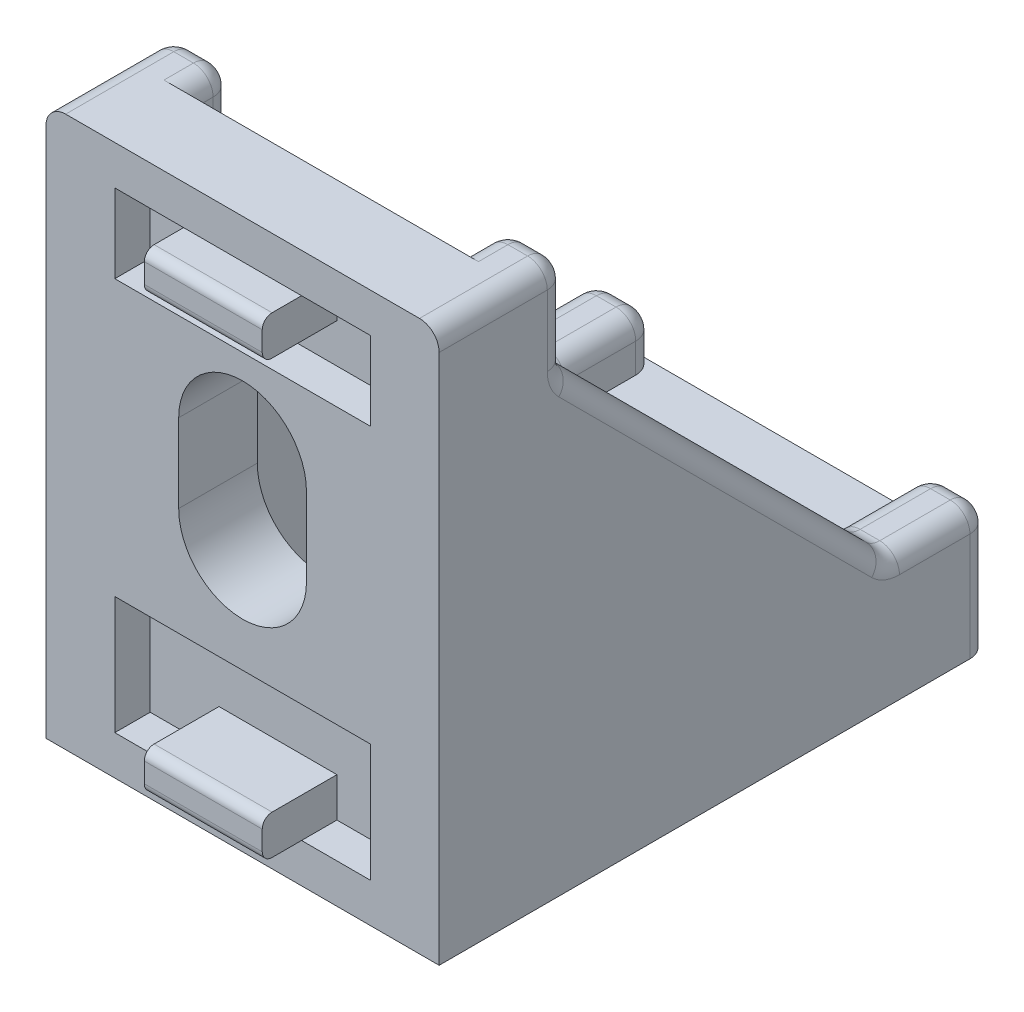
SolidWorks part; units mm, degrees
ref_plane "前视基准面" through (0, 0, 0) normal (0, 0, 1) x (1, 0, 0)
ref_plane "上视基准面" through (0, 0, 0) normal (0, 1, 0) x (1, 0, 0)
ref_plane "右视基准面" through (0, 0, 0) normal (1, 0, 0) x (0, 0, -1)
sketch "草图3" plane through (0, 0, 0) normal (1, 0, 0) x (0, 0, -1)
  line L0 (0, 0) -> (0, 28)
  line L1 (0, 28) -> (4, 28)
  line L2 (4, 28) -> (4, 4)
  line L3 (4, 4) -> (28, 4)
  line L4 (28, 4) -> (28, 0)
  line L5 (28, 0) -> (0, 0)
extrude "凸台-拉伸1" add sketch "草图3" along normal blind 17
sketch "草图6" plane through (17, 0, 0) normal (1, 0, 0) x (0, 0, -1)
  line L0 (4, 28) -> (6.5, 28)
  line L1 (6.5, 28) -> (6.5, 23)
  line L2 (28, 4) -> (28, 6.5)
  line L3 (28, 6.5) -> (23, 6.5)
  line L4 (6.5, 23) -> (23, 6.5)
  line L11 (0, 0) -> (28, 0)
  line L12 (28, 0) -> (28, 4)
  line L13 (28, 4) -> (4, 4)
  line L14 (4, 4) -> (4, 28)
  line L15 (4, 28) -> (0, 28)
  line L16 (0, 28) -> (0, 0)
  line L17 (0, 0) -> (28, 0)
  line L18 (28, 0) -> (28, 4)
  line L21 (4, 28) -> (0, 28)
  line L22 (0, 28) -> (0, 0)
  dimension "D1" = 0
extrude "凸台-拉伸2" add sketch "草图6" along normal blind 3
sketch "草图8" plane through (0, 0, 0) normal (-1, 0, 0) x (0, 0, 1)
  line L0 (-4, 28) -> (-6.5, 28)
  line L1 (-6.5, 28) -> (-6.5, 23)
  line L2 (-6.5, 23) -> (-23, 6.5)
  line L3 (-23, 6.5) -> (-28, 6.5)
  line L4 (-28, 6.5) -> (-28, 4)
  line L7 (-4, 4) -> (-28, 4)
  line L8 (-4, 4) -> (-4, 28)
extrude "凸台-拉伸3" add sketch "草图8" against normal blind 3
sketch "草图30" plane through (0, 0, -4) normal (0, 0, -1) x (-1, 0, 0)
  line L0 (-10, 28) -> (-10, 4) construction
  line L1 (-17, 28) -> (-3, 28) construction
  line L2 (-17, 4) -> (-3, 4) construction
  line L4 (-10, 17.5) -> (-10, 13.5) construction
  line L5 (-6.75, 17.5) -> (-6.75, 13.5)
  line L6 (-13.25, 17.5) -> (-13.25, 13.5)
  line L9 (-20, 0) -> (0, 0) construction
  arc A0 (-6.75, 17.5) -> (-13.25, 17.5) centre (-10, 17.5) ccw
  arc A1 (-13.25, 13.5) -> (-6.75, 13.5) centre (-10, 13.5) ccw
  point P8 (-10, 15.5)
  dimension "D1" = 13.5
extrude "切除-拉伸4" cut sketch "草图30" against normal through all
sketch "草图32" plane through (0, 4, 0) normal (0, 1, 0) x (1, 0, 0)
  line L0 (10, 28) -> (10, 4) construction
  line L1 (17, 28) -> (3, 28) construction
  line L2 (17, 4) -> (3, 4) construction
  line L3 (10, 17.5) -> (10, 13.5) construction
  line L4 (13.25, 17.5) -> (13.25, 13.5)
  line L5 (6.75, 17.5) -> (6.75, 13.5)
  line L6 (20, 28) -> (0, 28) construction
  line L7 (20, 0) -> (0, 0) construction
  arc A0 (13.25, 17.5) -> (6.75, 17.5) centre (10, 17.5) ccw
  arc A1 (6.75, 13.5) -> (13.25, 13.5) centre (10, 13.5) ccw
  point P8 (10, 15.5)
  dimension "D1" = 10.5
  dimension "D2" = 13.5
extrude "切除-拉伸5" cut sketch "草图32" against normal through all
fillet "圆角22" radius 1 8 edges at (3, 6.5, -25.5) (0, 6.5, -25.5) (3, 25.5, -6.5) (0, 25.5, -6.5) (1.5, 6.5, -23) (3, 14.75, -14.75) (1.5, 23, -6.5) (0, 14.75, -14.75)
fillet "圆角23" radius 1 8 edges at (20, 6.5, -25.5) (17, 6.5, -25.5) (20, 25.5, -6.5) (17, 25.5, -6.5) (18.5, 6.5, -23) (20, 14.75, -14.75) (18.5, 23, -6.5) (17, 14.75, -14.75)
fillet "圆角24" radius 1 5 edges at (17.2929, 6.2071, -28) (18.5, 6.5, -28) (19.7071, 6.2071, -28) (20, 2.75, -28)
fillet "圆角25" radius 1 5 edges at (3, 4.75, -28) (2.7071, 6.2071, -28) (1.5, 6.5, -28) (0.2929, 6.2071, -28) (0, 2.75, -28)
fillet "圆角26" radius 1 5 edges at (17.2929, 28, -6.2071) (18.5, 28, -6.5) (19.7071, 28, -6.2071) (20, 28, -2.75)
fillet "圆角27" radius 1 5 edges at (3, 28, -4.75) (2.7071, 28, -6.2071) (1.5, 28, -6.5) (0.2929, 28, -6.2071) (0, 28, -2.75)
sketch "草图41" plane through (0, 0, 0) normal (0, -1, 0) x (1, 0, 0)
  line L0 (10, 0) -> (10, -28)
  line L1 (20, 0) -> (0, 0) construction
  line L2 (19, -28) -> (1, -28) construction
  line L3 (10, -28) -> (10, -30.8554)
  line L4 (7, -2) -> (13, -2)
  line L5 (7, -2) -> (7, -4)
  line L6 (7, -4) -> (13, -4)
  line L7 (13, -4) -> (13, -2)
  dimension "D1" = 6
  dimension "D2" = 2
  dimension "D3" = 7
  dimension "D4" = 2
extrude "凸台-拉伸7" add sketch "草图41" along normal blind 2 contours L6 L7 L4 L0 | L5 L6 L0 L4
sketch "草图42" plane through (0, 0, 0) normal (0, -1, 0) x (1, 0, 0)
  line L0 (7, -24) -> (13, -24)
  line L1 (13, -24) -> (13, -26)
  line L2 (13, -26) -> (7, -26)
  line L3 (7, -26) -> (7, -24)
  line L4 (20, 0) -> (20, -27) construction
  line L5 (19, -28) -> (1, -28) construction
  dimension "D1" = 6
  dimension "D2" = 2
  dimension "D3" = 7
  dimension "D4" = 2
extrude "凸台-拉伸8" add sketch "草图42" along normal blind 2
sketch "草图43" plane through (0, 0, 0) normal (0, -1, 0) x (1, 0, 0)
  line L0 (7, -2) -> (3.5, -2)
  line L1 (3.5, -2) -> (3.5, -8)
  line L2 (3.5, -8) -> (16.5, -8)
  line L3 (16.5, -8) -> (16.5, -2)
  line L4 (16.5, -2) -> (13, -2)
  line L5 (13, -2) -> (13, -4)
  line L6 (13, -4) -> (7, -4)
  line L7 (7, -2) -> (7, -4)
  line L8 (7, -2) -> (7, -4)
  line L9 (0, 0) -> (0, -27) construction
  line L10 (20, 0) -> (20, -27) construction
  dimension "D1" = 3.5
  dimension "D2" = 6
  dimension "D3" = 3.5
extrude "切除-拉伸6" cut sketch "草图43" against normal blind 1.8 contours L3 L4 L0 L1 L2 M4 M1 M2
sketch "草图48" plane through (0, 0, 0) normal (0, -1, 0) x (1, 0, 0)
  line L0 (13, -26) -> (16.5, -26)
  line L1 (16.5, -26) -> (16.5, -22)
  line L2 (16.5, -22) -> (3.5, -22)
  line L3 (3.5, -22) -> (3.5, -26)
  line L4 (3.5, -26) -> (7, -26)
  line L5 (7, -26) -> (7, -24)
  line L6 (7, -24) -> (13, -24)
  line L7 (13, -24) -> (13, -26)
  line L8 (20, 0) -> (20, -27) construction
  line L9 (0, 0) -> (0, -27) construction
  dimension "D1" = 3.5
  dimension "D2" = 3.5
  dimension "D3" = 4
extrude "切除-拉伸7" cut sketch "草图48" against normal blind 1.8
fillet "圆角28" radius 0.5 1 edges at (10, -2, -4)
fillet "圆角29" radius 0.5 1 edges at (10, -2, -2)
fillet "圆角30" radius 0.5 1 edges at (10, -2, -26)
fillet "圆角31" radius 0.5 1 edges at (10, -2, -24)
ref_plane "基准面1" through (0, 0, 0) normal (0, 0.7071, 0.7071) x (1, 0, 0)
mirror "镜向1" about plane through (0, 0, 0) normal (0, 0.7071, 0.7071) of "凸台-拉伸8", "切除-拉伸7", "凸台-拉伸7", "切除-拉伸6"
fillet "圆角33" radius 0.5 1 edges at (10, 4, 2)
fillet "圆角34" radius 0.5 1 edges at (10, 2, 2)
fillet "圆角35" radius 0.5 1 edges at (10, 24, 2)
fillet "圆角36" radius 0.5 1 edges at (10, 26, 2)
